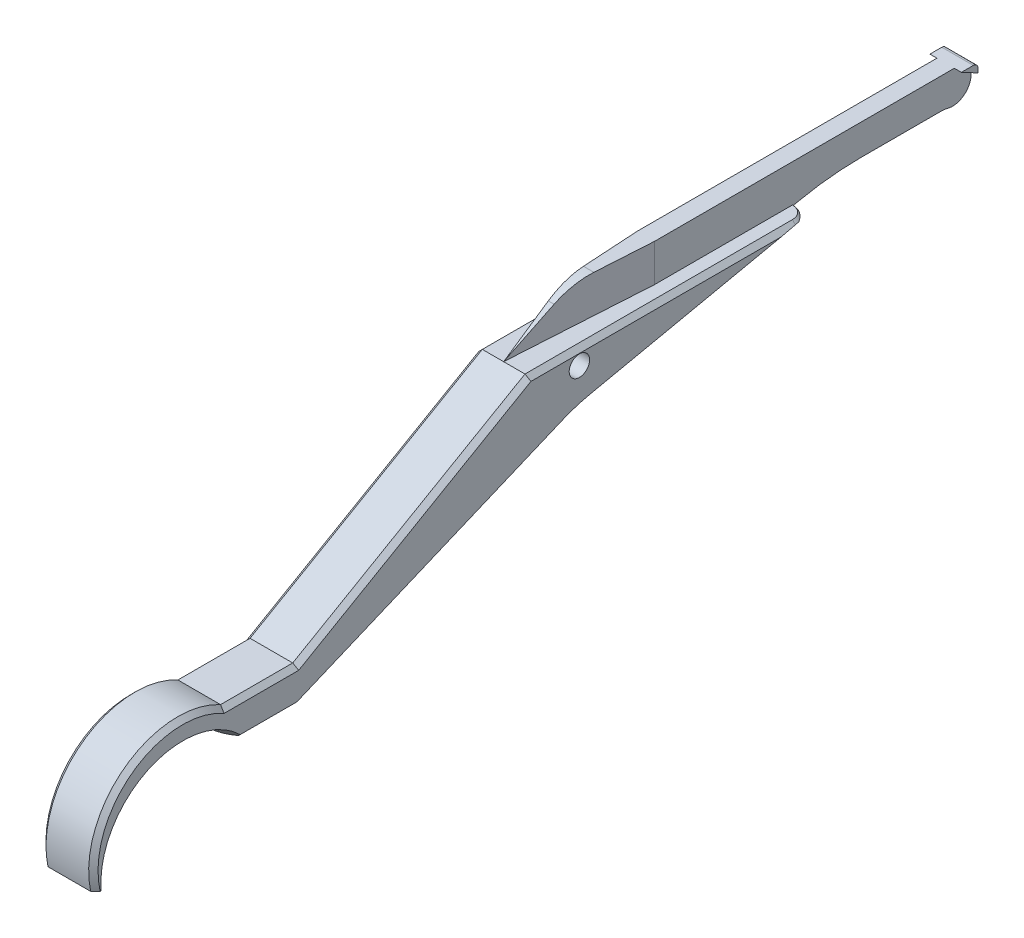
SolidWorks part; units mm, degrees
ref_plane "Спереди" through (0, 0, 0) normal (0, 0, 1) x (1, 0, 0)
ref_plane "Сверху" through (0, 0, 0) normal (0, 1, 0) x (1, 0, 0)
ref_plane "Справа" through (0, 0, 0) normal (1, 0, 0) x (0, 0, -1)
sketch "Эскиз1" plane through (0, 0, 0) normal (1, 0, 0) x (0, 0, -1)
  line L0 (-59.9692, -20.1168) -> (-47.752, -20.1168)
  line L1 (-47.752, -20.1168) -> (-0.3698, 7.2393)
  line L2 (5.9802, 8.9408) -> (68.4466, 8.9408)
  line L3 (-58.7551, -25.781) -> (-47.752, -25.781)
  line L4 (-47.752, -25.781) -> (-2.6727, -6.8913)
  line L5 (1.8628, -5.4728) -> (40.0734, 2.6491)
  line L6 (50.6353, 3.7592) -> (64.3244, 3.7592)
  line L7 (69.2404, 8.147) -> (69.2404, 6.1971)
  line L8 (65.8622, 20.1808) -> (65.8622, -5.7256) construction
  line L9 (-81.969, -36.5125) -> (-79.7814, -36.5125)
  line L10 (-3.2658, -7.1399) -> (-0.4716, -5.969) construction
  line L11 (-0.4716, -5.969) -> (1.8628, -5.4728) construction
  circle A0 centre (0, 0) radius 1.7272
  arc A1 (69.2404, 6.1971) -> (65.2134, 3.6322) centre (66.1024, 6.6802) cw
  arc A2 (-59.9692, -20.1168) -> (-81.969, -36.5125) centre (-67.2257, -33.3375) ccw
  arc A3 (-79.7814, -36.5125) -> (-58.7551, -25.781) centre (-67.1373, -35.3219) cw
  arc A4 (-2.6727, -6.8913) -> (1.8628, -5.4728) centre (7.1437, -30.3178) cw
  arc A5 (40.0734, 2.6491) -> (50.6353, 3.7592) centre (50.6353, -47.0408) cw
  arc A6 (64.3244, 3.7592) -> (65.2134, 3.6322) centre (64.3244, 0.5842) cw
  arc A7 (68.4466, 8.9408) -> (69.2404, 8.147) centre (68.4466, 8.1471) cw
  arc A8 (-0.3698, 7.2393) -> (5.9802, 8.9408) centre (5.9802, -3.7592) cw
  point P14 (66.1024, 3.5052)
  point P21 (-67.2257, -18.2562)
  point P22 (-67.1373, -22.6219)
  dimension "D1" = 3.4544
  dimension "D7" = 3.175
  dimension "D13" = 15.0812
  dimension "D15" = 12.7
  dimension "D19" = 25.4
  dimension "D22" = 50.8
  dimension "D24" = 3.175
  dimension "D25" = 0.7937
  dimension "D26" = 12.7
  dimension "D2" = 8.9408
  dimension "D3" = 5.6642
  dimension "D4" = 30
  dimension "D5" = 12
  dimension "D6" = 25.781
  dimension "D8" = 5.4356
  dimension "D9" = 5.1816
  dimension "D10" = 65.8622
  dimension "D11" = 69.2404
  dimension "D12" = 18.2562
  dimension "D14" = 36.5125
  dimension "D16" = 22.6219
  dimension "D17" = 79.7814
  dimension "D18" = 151.2094
  dimension "D20" = 7.1437
  dimension "D21" = 47.752
  dimension "D23" = 5.969
extrude "Бобышка-Вытянуть1" add sketch "Эскиз1" along normal mid plane 8.8138
sketch "Эскиз2" plane through (0, 0, 0) normal (1, 0, 0) x (0, 0, -1)
  arc A0 (-79.7814, -36.5125) -> (-54.4373, -35.3219) centre (-67.1373, -35.3219) cw
  arc A1 (-58.7551, -25.781) -> (-79.7814, -36.5125) centre (-67.1373, -35.3219) ccw construction
sketch "Эскиз3" plane through (0, -36.5125, 0) normal (0, -1, 0) x (1, 0, 0)
  line L0 (0, 79.7814) -> (0, 75.9415) construction
  line L1 (-4.4069, 81.969) -> (-4.4069, 79.7814) construction
  line L2 (4.4069, 81.969) -> (4.4069, 79.7814) construction
  line L5 (4.4069, 80.9751) -> (4.4069, 79.5274)
  line L6 (4.4069, 79.5274) -> (-4.4069, 79.5274)
  line L7 (-4.4069, 79.5274) -> (-4.4069, 80.9751)
  arc A0 (-4.4069, 80.9751) -> (4.4069, 80.9751) centre (0, 88.5126) ccw
  dimension "D2" = 8.7312
  dimension "D1" = 0.254
sweep "Вырез-По траектории1" cut profiles "Эскиз3" path "Эскиз2"
sketch "Эскиз4" plane through (4.4069, 0, 0) normal (1, 0, 0) x (0, 0, -1)
  line L0 (-8.4213, 2.5908) -> (69.2404, 2.5908)
  line L1 (69.2404, 2.5908) -> (69.2404, 7.4422)
  line L2 (69.2404, 7.4422) -> (66.4219, 8.9408)
  line L3 (68.4466, 8.9408) -> (5.9802, 8.9408) construction
  line L4 (66.4219, 8.9408) -> (-8.4213, 8.9408)
  line L5 (-8.4213, 8.9408) -> (-8.4213, 2.5908)
  line L6 (69.2404, 6.1971) -> (69.2404, 8.147) construction
  line L8 (-0.3698, 7.2393) -> (-47.752, -20.1168) construction
  arc A0 (65.2134, 3.6322) -> (69.2404, 6.1971) centre (66.1024, 6.6802) ccw construction
  point P11 (66.1024, 3.5052)
  point P13 (66.1024, 6.6802)
  dimension "D1" = 2.5908
  dimension "D2" = 28
  dimension "D3" = 3.937
extrude "Вырез-Вытянуть1" cut sketch "Эскиз4" against normal offset from surface (2.9337 mm away) 1.4732
mirror "Зеркальное отражение1" about plane through (0, 0, 0) normal (1, 0, 0) of "Вырез-Вытянуть1"
sketch "Эскиз5" plane through (0, 8.9408, 0) normal (0, 1, 0) x (1, 0, 0)
  line L0 (-4.4069, 36.8654) -> (-4.4069, 69.2404)
  line L1 (-4.4069, 69.2404) -> (-2.667, 69.2404)
  line L2 (-2.667, 69.2404) -> (-2.667, 39.7991)
  line L3 (-2.667, 39.7991) -> (-1.4732, 39.7991)
  line L4 (-1.4732, 66.4219) -> (-1.4732, 5.9802) construction
  line L5 (-1.4732, 39.7991) -> (-4.4069, 39.7991) construction
  line L6 (-4.4069, -8.4213) -> (-4.4069, 39.7991) construction
  line L7 (4.4069, 69.2404) -> (-4.4069, 69.2404) construction
  line L8 (0, 0) -> (0, 76.6802) construction
  line L9 (2.667, 39.7991) -> (1.4732, 39.7991)
  line L10 (2.667, 69.2404) -> (2.667, 39.7991)
  line L11 (4.4069, 69.2404) -> (2.667, 69.2404)
  line L12 (4.4069, 36.8654) -> (4.4069, 69.2404)
  arc A0 (-1.4732, 39.7991) -> (-4.4069, 36.8654) centre (-1.4732, 36.8654) ccw
  arc A1 (1.4732, 39.7991) -> (4.4069, 36.8654) centre (1.4732, 36.8654) cw
  dimension "D1" = 2.667
extrude "Вырез-Вытянуть2" cut sketch "Эскиз5" against normal through all
sketch "Эскиз6" plane through (0, 2.5908, 0) normal (0, 1, 0) x (1, 0, 0)
  line L0 (0, 19.9564) -> (0, -24.554) construction
  line L1 (-1.4732, 15.6653) -> (-1.4732, -10.0964)
  line L2 (-1.4732, -8.4213) -> (-1.4732, 39.7991) construction
  line L3 (-1.4732, -10.0964) -> (1.4732, -10.0964)
  line L4 (1.4732, -10.0964) -> (1.4732, 15.6653)
  line L5 (1.4732, 15.6653) -> (0, -8.4213)
  line L6 (0, -8.4213) -> (-1.4732, 15.6653)
  line L7 (1.4732, 39.7991) -> (1.4732, -8.4213) construction
  line L8 (-1.4732, -8.4213) -> (-4.4069, -8.4213) construction
  dimension "D1" = 7
extrude "Вырез-Вытянуть3" cut sketch "Эскиз6" along normal through all
chamfer "Фаска1" distance 0.7937 angle 45 10 edges at (-3.5476, 2.5908, -38.9399) (-4.4069, -21.2451, 76.2378) (-4.4069, -20.1168, 53.8606) (-4.4069, -8.763, 28.0866) (-4.4069, 2.5908, -14.2221) (3.5476, 2.5908, -38.9399) (4.4069, -21.2451, 76.2378) (4.4069, -20.1168, 53.8606) (4.4069, -8.763, 28.0866) (4.4069, 2.5908, -14.2221)
chamfer "Фаска2" distance 0.3969 angle 45 8 edges at (4.4069, -1.8379, -18.9638) (4.4069, -6.0758, 0.4382) (4.4069, -25.781, 52.398) (4.4069, -16.3362, 25.2123) (-4.4069, -1.8379, -18.9638) (-4.4069, -6.0758, 0.4382) (-4.4069, -16.3362, 25.2123) (-4.4069, -25.781, 52.398)
